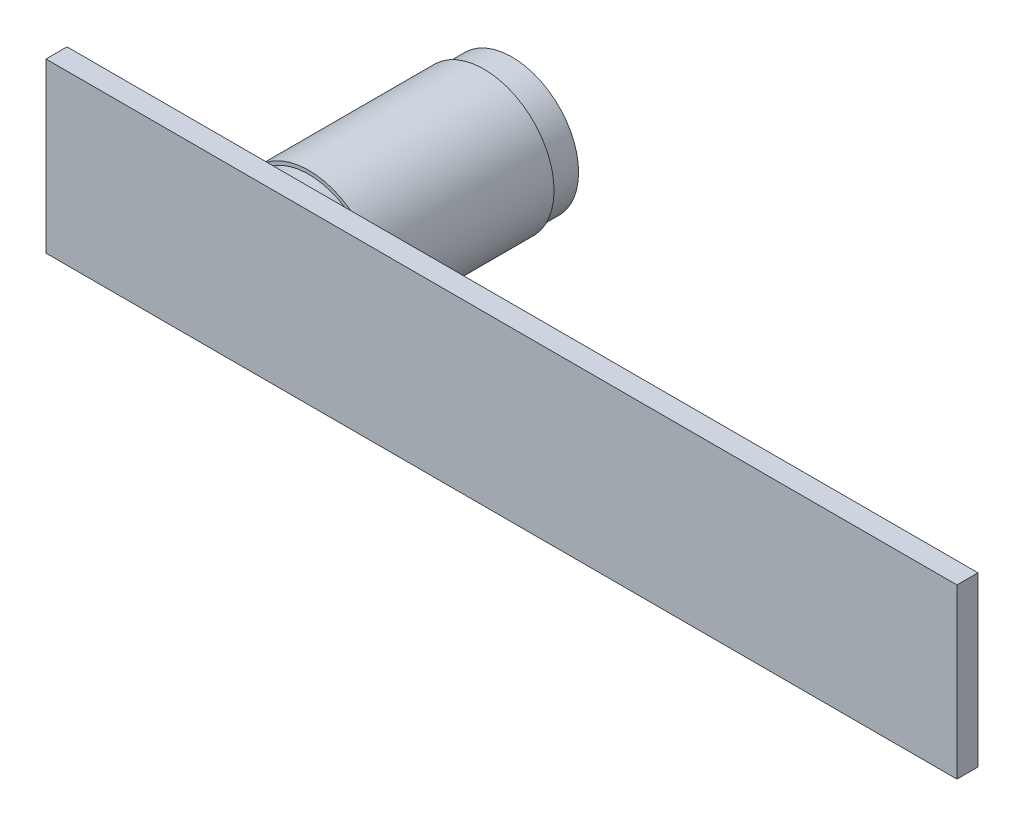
SolidWorks part; units mm, degrees
ref_plane "Front Plane" through (0, 0, 0) normal (0, 0, 1) x (1, 0, 0)
ref_plane "Top Plane" through (0, 0, 0) normal (0, 1, 0) x (1, 0, 0)
ref_plane "Right Plane" through (0, 0, 0) normal (1, 0, 0) x (0, 0, -1)
sketch "Sketch1" plane through (0, 0, 0) normal (1, 0, 0) x (0, 0, -1)
  line L0 (-33.6234, -8.7825) -> (-0.6234, -8.7825)
  line L1 (-29.6234, 1.2175) -> (-4.6234, 1.2175)
  line L2 (-17.1234, -8.7825) -> (-0.6234, -8.7825) construction
  line L3 (-33.6234, 0.7175) -> (-33.6234, -8.7825)
  line L4 (-4.6234, 1.2175) -> (-4.6234, 0.7175)
  line L5 (-0.6234, -8.7825) -> (-0.6234, 0.7175) construction
  line L6 (-29.6234, 0.7175) -> (-33.6234, 0.7175)
  line L7 (-4.6234, 0.7175) -> (-0.6234, 0.7175)
  line L8 (-29.6234, 1.2175) -> (-29.6234, 0.7175)
  line L10 (-0.6234, 0.7175) -> (-0.6234, -8.7825)
revolve "Revolve1" add sketch "Sketch1" angle 360 about L0
sketch "Sketch2" plane through (0, 0, 33.6234) normal (0, 0, 1) x (1, 0, 0)
  line L1 (-30.5, -20.7825) -> (99.5, -20.7825)
  line L3 (-30.5, -20.7825) -> (-30.5, 3.2175)
  line L4 (-30.5, 3.2175) -> (99.5, 3.2175)
  line L5 (99.5, -20.7825) -> (99.5, 3.2175)
extrude "Boss-Extrude1" add sketch "Sketch2" along normal blind 3
sketch "Sketch3" plane through (0, 0, 33.6234) normal (0, 0, -1) x (-1, 0, 0)
  line L0 (30.5, -8.7825) -> (24.5, -8.7825) construction
  line L1 (30.5, 3.2175) -> (30.5, -20.7825) construction
  line L2 (-34.5, -20.7825) -> (-34.5, 3.2175) construction
  line L3 (30.5, -20.7825) -> (-99.5, -20.7825) construction
  line L4 (-99.5, 3.2175) -> (30.5, 3.2175) construction
  line L5 (24.5, -8.7825) -> (19.5, -8.7825) construction
  circle A0 centre (19.5, -8.7825) radius 5
extrude "Boss-Extrude2" add sketch "Sketch3" along normal blind 3
ref_plane "Plane1" through (0, 3.2175, 0) normal (0, 1, 0) x (1, 0, 0)
ref_plane "Plane2" through (0, -8.7825, 0) normal (0, 1, 0) x (1, 0, 0)
sketch "Sketch4" plane through (0, -8.7825, 0) normal (0, 1, 0) x (1, 0, 0)
  line L0 (-24.5, -30.6234) -> (-23.5, -30.6234) construction
  line L1 (-14.5, -30.6234) -> (-24.5, -30.6234) construction
  line L2 (-14.5, -30.6234) -> (-15.5, -30.6234) construction
  line L5 (-23.5, -30.6234) -> (-23.5, -29.0365)
  line L6 (-23.5, -29.0365) -> (-15.5, -29.0365)
  line L7 (-15.5, -30.6234) -> (-15.5, -29.0365)
  arc A0 (-23.5, -30.6234) -> (-15.5, -30.6234) centre (-19.5, -26.6234) ccw
  dimension "D1" = 5.6569
  dimension "D2" = 1
  dimension "D3" = 1
extrude "Cut-Extrude1" cut sketch "Sketch4" against normal mid plane 2
ref_plane "Plane3" through (-30.5, 0, 0) normal (-1, 0, 0) x (0, 0, 1)
ref_plane "Plane4" through (34.5, 0, 0) normal (-1, 0, 0) x (0, 0, 1)
mirror "Mirror1" about plane through (34.5, 0, 0) normal (-1, 0, 0) of "Cut-Extrude1", "Boss-Extrude2"
